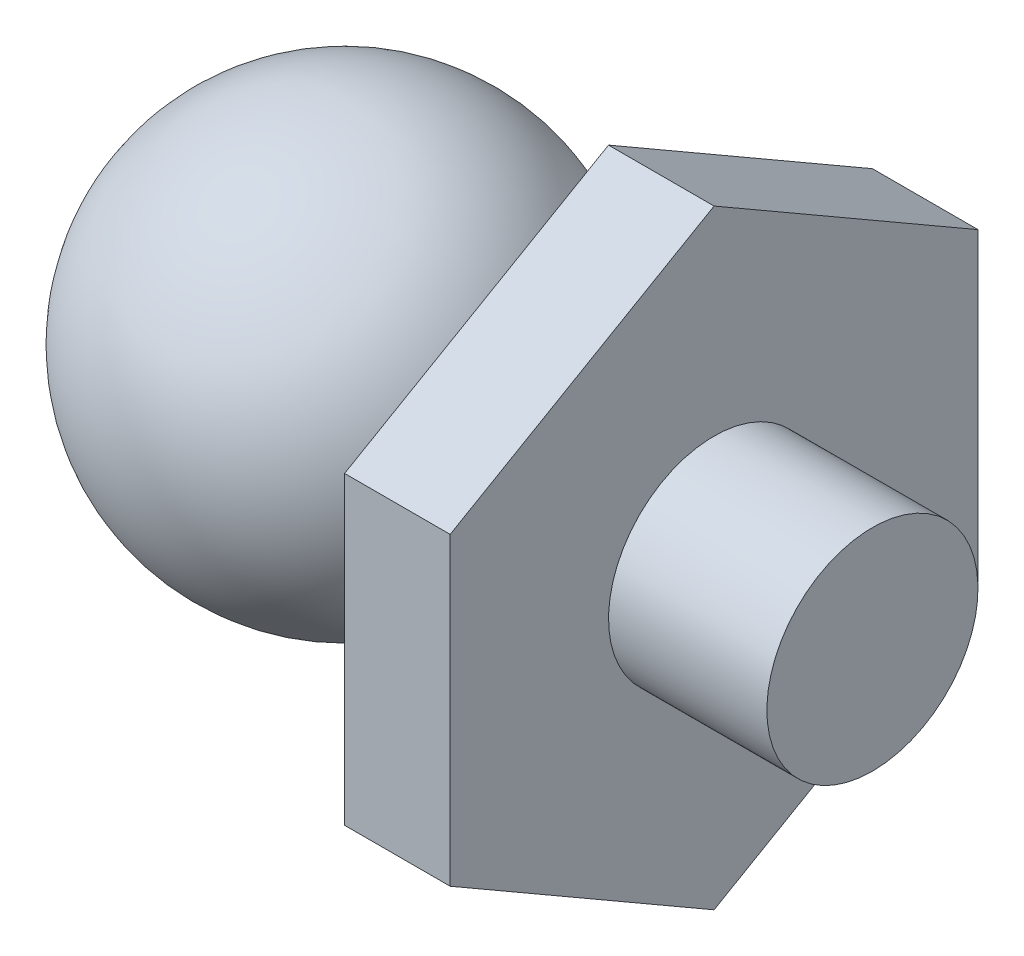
SolidWorks part; units mm, degrees
ref_plane "Plan1" through (0, 0, 0) normal (0, 0, 1) x (1, 0, 0)
ref_plane "Plan2" through (0, 0, 0) normal (0, 1, 0) x (1, 0, 0)
ref_plane "Plan3" through (0, 0, 0) normal (1, 0, 0) x (0, 0, -1)
sketch "Esquisse1" plane through (0, 0, 0) normal (0, 0, 1) x (1, 0, 0)
  line L0 (0, 0) -> (1.6523, 0) construction
  line L1 (5, 0) -> (-2, 0)
  line L2 (5, 0) -> (5, 1)
  line L3 (5, 1) -> (1.7321, 1)
  arc A0 (1.7321, 1) -> (-2, 0) centre (0, 0) ccw
  dimension "D1" = 5
revolve "Base-Révolution" add sketch "Esquisse1" angle 360 about L0
ref_plane "Plan4" through (3.5, 0, 0) normal (1, 0, 0) x (0, 0, -1)
sketch "Esquisse2" plane through (3.5, 0, 0) normal (1, 0, 0) x (0, 0, -1)
  line L1 (0, -2.8868) -> (2.5, -1.4434)
  line L2 (2.5, -1.4434) -> (2.5, 1.4434)
  line L3 (2.5, 1.4434) -> (0, 2.8868)
  line L4 (0, 2.8868) -> (-2.5, 1.4434)
  line L5 (-2.5, 1.4434) -> (-2.5, -1.4434)
  line L6 (-2.5, -1.4434) -> (0, -2.8868)
  circle A0 centre (0, 0) radius 2.5 construction
extrude "Boss.-Extru.1" add sketch "Esquisse2" against normal blind 1
